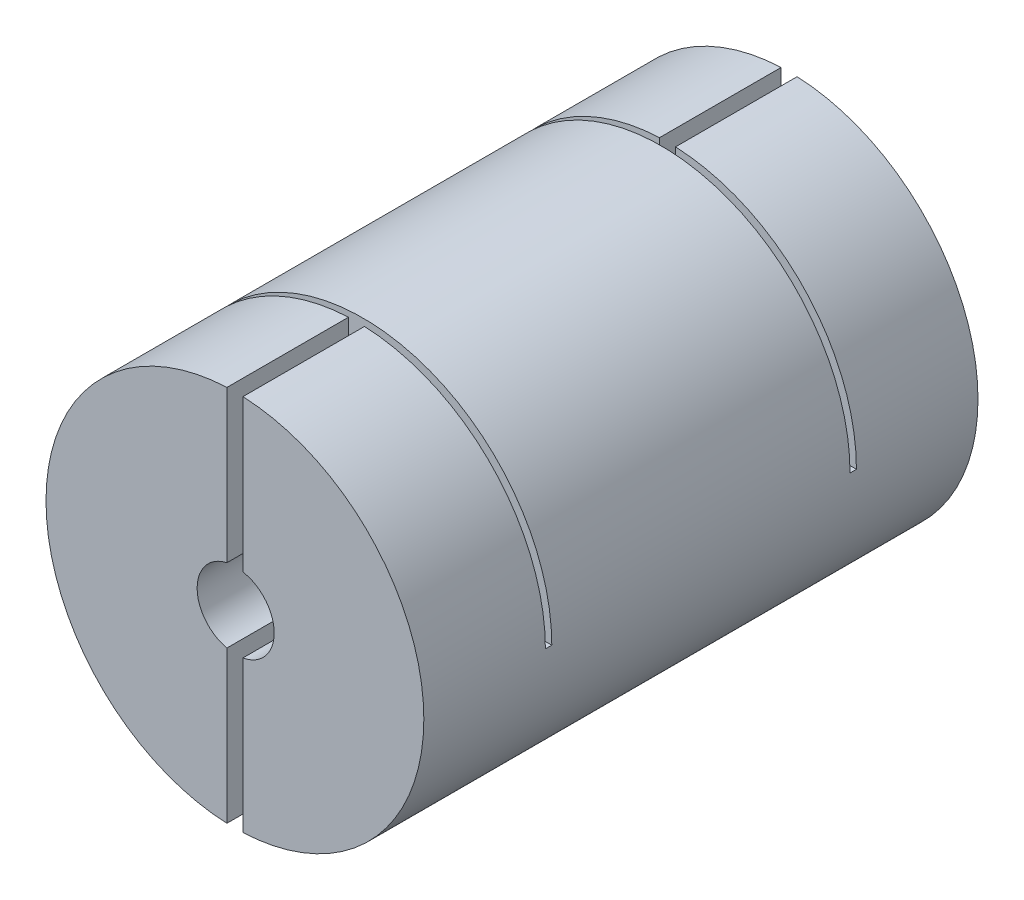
SolidWorks part; units mm, degrees
ref_plane "Front" through (0, 0, 0) normal (0, 0, 1) x (1, 0, 0)
ref_plane "Top" through (0, 0, 0) normal (0, 1, 0) x (1, 0, 0)
ref_plane "Right" through (0, 0, 0) normal (1, 0, 0) x (0, 0, -1)
sketch "Sketch1" plane through (0, 0, 0) normal (0, 0, 1) x (1, 0, 0)
  circle A0 centre (0, 0) radius 7.5
  dimension "D1" = 15
extrude "Extrude1" add sketch "Sketch1" along normal blind 11
sketch "Sketch4" plane through (0, 0, 11) normal (0, 0, -1) x (-1, 0, 0)
  line L1 (0.3175, 0.8151) -> (-0.3175, 0.8151)
  line L2 (0.3175, 0.8151) -> (0.3175, 8.0168)
  line L3 (0.3175, 8.0168) -> (-0.3175, 8.0168)
  line L4 (-0.3175, 0.8151) -> (-0.3175, 8.0168)
  dimension "D1" = 0.3175
  dimension "D2" = 0.635
extrude "Cut-Extrude3" cut sketch "Sketch4" along normal blind 4.826
sketch "Sketch5" plane through (0, 0, 11) normal (0, 0, -1) x (-1, 0, 0)
  line L1 (-0.3175, -0.7718) -> (0.3175, -0.7718)
  line L2 (-0.3175, -0.7718) -> (-0.3175, -8.6847)
  line L3 (-0.3175, -8.6847) -> (0.3175, -8.6847)
  line L4 (0.3175, -0.7718) -> (0.3175, -8.6847)
  dimension "D1" = 0.3175
  dimension "D2" = 0.635
extrude "Cut-Extrude4" cut sketch "Sketch5" along normal blind 2.413
sketch "Sketch6" plane through (0, 0, 0) normal (0, 1, 0) x (1, 0, 0)
  line L0 (-0.3175, -6.174) -> (0.3175, -6.174) construction
  line L1 (-11.5705, -5.92) -> (10.3258, -5.92)
  line L2 (-11.5705, -5.92) -> (-11.5705, -6.174)
  line L3 (-11.5705, -6.174) -> (10.3258, -6.174)
  line L4 (10.3258, -5.92) -> (10.3258, -6.174)
  dimension "D1" = 0.254
extrude "Cut-Extrude5" cut sketch "Sketch6" along normal blind 14.6367
mirror "Mirror1" about plane through (0, 0, 0) normal (0, 0, 1) of "Cut-Extrude5", "Cut-Extrude4", "Cut-Extrude3", "Extrude1"
hole_wizard "Ø3.0 (3) Diameter Hole1" positions "Sketch8" profile "Sketch7" hole size "Ø3.0" standard "Ansi Metric"
sketch "Sketch8" plane through (0, 0, 11) normal (0, 0, 1) x (1, 0, 0)
  point P0 (0.0594, -0.0124)
sketch "Sketch7" plane through (0.0594, -0.0124, 11) normal (1, 0, 0) x (0, -1, 0)
  line L0 (0, 0) -> (0, 22)
  line L1 (0, 22) -> (1.5, 22)
  line L2 (1.5, 22) -> (1.5, 0)
  line L5 (1.5, 0) -> (0, 0)
  line L11 (0, -6.35) -> (0, 107.95) construction
  dimension "Thru Hole Dia." = 3
  dimension "Thru Hole Depth" = 22
sketch "Sketch2" plane through (0, 0, 0) normal (0, 0, 1) x (1, 0, 0)
  circle A0 centre (0, 0) radius 1.5
  dimension "D1" = 3
extrude "Cut-Extrude1" cut sketch "Sketch2" against normal through all
sketch "Sketch3" plane through (0, 0, 0) normal (0, 0, 1) x (1, 0, 0)
  circle A0 centre (0, 0) radius 1.5
  circle A1 centre (0, 0) radius 1.5 construction
  dimension "D1" = 3
extrude "Cut-Extrude2" cut sketch "Sketch3" along normal through all
